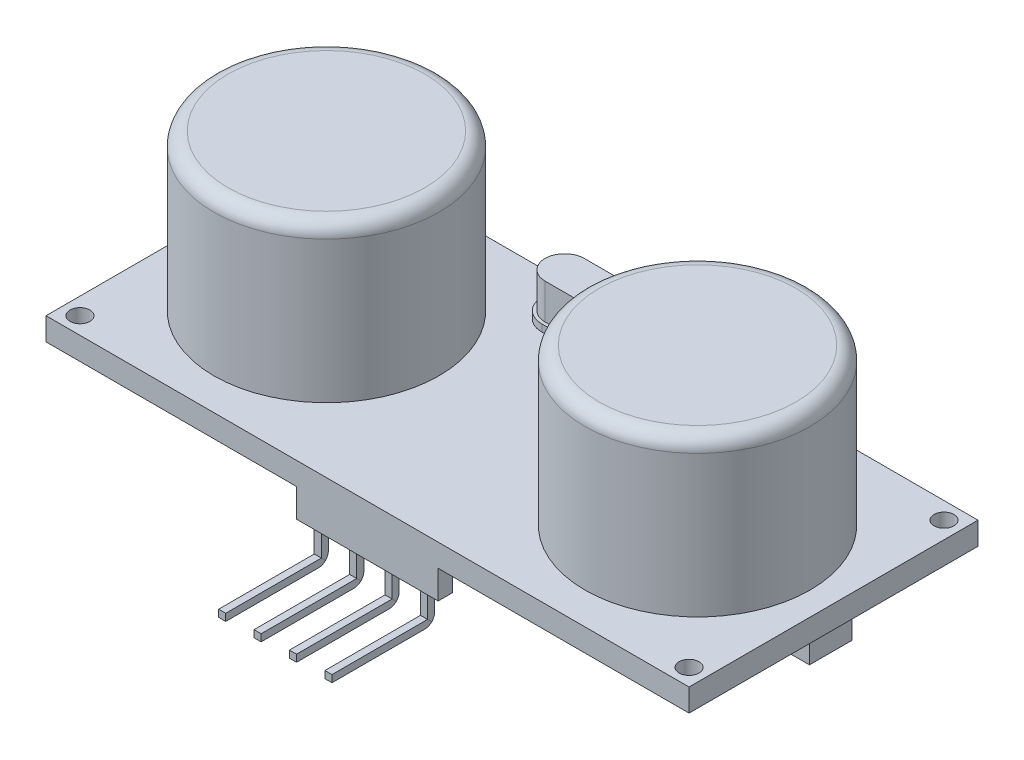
SolidWorks part; units mm, degrees
ref_plane "Alzado" through (0, 0, 0) normal (0, 0, 1) x (1, 0, 0)
ref_plane "Planta" through (0, 0, 0) normal (0, 1, 0) x (1, 0, 0)
ref_plane "Vista lateral" through (0, 0, 0) normal (1, 0, 0) x (0, 0, -1)
sketch "Croquis1" plane through (0, 0, 0) normal (0, 1, 0) x (1, 0, 0)
  line L1 (-22.7, 10.2) -> (22.7, 10.2)
  line L2 (-22.7, 10.2) -> (-22.7, -10.2)
  line L3 (-22.7, -10.2) -> (22.7, -10.2)
  line L4 (22.7, 10.2) -> (22.7, -10.2)
  line L5 (-22.7, 10.2) -> (22.7, -10.2) construction
  line L6 (-22.7, -10.2) -> (22.7, 10.2) construction
  point P0 (0, 0)
  dimension "D1" = 45.4
  dimension "D2" = 20.4
extrude "Saliente-Extruir1" add sketch "Croquis1" along normal blind 1.6
sketch "Croquis2" plane through (0, 1.6, 0) normal (0, 1, 0) x (1, 0, 0)
  line L5 (-21.5, 9) -> (21.5, -9) construction
  line L6 (-21.5, -9) -> (21.5, 9) construction
  circle A0 centre (-21.5, 9) radius 0.7
  circle A1 centre (21.5, 9) radius 0.7
  circle A2 centre (21.5, -9) radius 0.7
  circle A3 centre (-21.5, -9) radius 0.7
  point P0 (0, 0)
  dimension "D3" = 1.4
  dimension "D1" = 43
  dimension "D2" = 18
extrude "Cortar-Extruir1" cut sketch "Croquis2" against normal blind 1
sketch "Croquis3" plane through (0, 1.6, 0) normal (0, 1, 0) x (1, 0, 0)
  line L0 (0, 10.2) -> (0, -10.2) construction
  line L1 (22.7, 10.2) -> (-22.7, 10.2) construction
  line L2 (-22.7, -10.2) -> (22.7, -10.2) construction
  line L3 (-4.2022, 7.9196) -> (4.2022, 7.9196) construction
  line L4 (-4.2022, 9.5358) -> (4.2022, 9.5358)
  line L5 (-4.2022, 6.3033) -> (4.2022, 6.3033)
  line L6 (-4.2022, 7.9196) -> (4.2022, 7.9196) construction
  line L7 (-4.2022, 9.3049) -> (4.2022, 9.3049)
  line L8 (-4.2022, 6.5342) -> (4.2022, 6.5342)
  arc A0 (-4.2022, 9.5358) -> (-4.2022, 6.3033) centre (-4.2022, 7.9196) ccw
  arc A1 (4.2022, 6.3033) -> (4.2022, 9.5358) centre (4.2022, 7.9196) ccw
  arc A2 (-4.2022, 9.3049) -> (-4.2022, 6.5342) centre (-4.2022, 7.9196) ccw
  arc A3 (4.2022, 6.5342) -> (4.2022, 9.3049) centre (4.2022, 7.9196) ccw
  point P8 (0, 7.9196)
  point P15 (0, 7.9196)
extrude "Saliente-Extruir2" add sketch "Croquis3" along normal blind 0.5 contours L8 A3 L7 A2 | L5 A1 L4 A0
sketch "Croquis8" plane through (0, 1.6, 0) normal (0, 1, 0) x (1, 0, 0)
  line L0 (-4.2022, 9.3049) -> (4.2022, 9.3049) construction
  line L1 (-4.2022, 6.5342) -> (4.2022, 6.5342) construction
  line L2 (-4.2022, 9.3049) -> (4.2022, 9.3049)
  line L3 (-4.2022, 6.5342) -> (4.2022, 6.5342)
  arc A0 (4.2022, 6.5342) -> (4.2022, 9.3049) centre (4.2022, 7.9196) ccw construction
  arc A1 (-4.2022, 9.3049) -> (-4.2022, 6.5342) centre (-4.2022, 7.9196) ccw construction
  arc A2 (4.2022, 6.5342) -> (4.2022, 9.3049) centre (4.2022, 7.9196) ccw
  arc A3 (-4.2022, 9.3049) -> (-4.2022, 6.5342) centre (-4.2022, 7.9196) ccw
extrude "Saliente-Extruir3" add sketch "Croquis8" along normal blind 3
sketch "Croquis9" plane through (0, 1.6, 0) normal (0, 1, 0) x (1, 0, 0)
  line L0 (-21.05, 0) -> (21.05, 0) construction
  line L3 (-22.7, 10.2) -> (0, -10.2) construction
  line L4 (-22.7, -10.2) -> (22.7, -10.2) construction
  line L5 (0, -10.2) -> (22.7, 10.2) construction
  line L6 (-22.7, -10.2) -> (0, 10.2) construction
  line L7 (22.7, 10.2) -> (-22.7, 10.2) construction
  line L8 (0, 10.2) -> (22.7, -10.2) construction
  circle A0 centre (-13.1, 0) radius 7.95
  circle A1 centre (13.1, 0) radius 7.95
  point P2 (0, 0)
  dimension "D1" = 15.9
  dimension "D2" = 15.9
  dimension "D3" = 42.1
extrude "Saliente-Extruir4" add sketch "Croquis9" along normal blind 11
sketch "Croquis10" plane through (0, 0, 0) normal (0, -1, 0) x (1, 0, 0)
  line L0 (0, 10.2) -> (0, -10.2) construction
  line L1 (-22.7, 10.2) -> (22.7, 10.2) construction
  line L2 (22.7, -10.2) -> (-22.7, -10.2) construction
  line L3 (22.7, 0) -> (-22.7, 0) construction
  line L4 (22.7, 10.2) -> (22.7, -10.2) construction
  line L5 (-22.7, -10.2) -> (-22.7, 10.2) construction
  line L6 (-5.0127, 10.2) -> (4.9873, 10.2)
  line L7 (-5.0127, 10.2) -> (-5.0127, 9.2)
  line L8 (-5.0127, 9.2) -> (4.9873, 9.2)
  line L9 (4.9873, 9.2) -> (4.9873, 10.2)
  point P15 (-0.0127, 10.2)
  dimension "D1" = 10
  dimension "D2" = 1
extrude "Saliente-Extruir5" add sketch "Croquis10" along normal blind 2
sketch "Croquis11" plane through (0, -2, 0) normal (0, -1, 0) x (1, 0, 0)
  line L0 (-5.0127, 10.2) -> (-0.0127, 10.2) construction
  line L1 (4.9873, 10.2) -> (-5.0127, 10.2) construction
  line L2 (-2.5127, 10.2) -> (-2.5127, 9.2) construction
  line L3 (-5.0127, 9.2) -> (4.9873, 9.2) construction
  line L4 (-5.0127, 10.2) -> (-2.5127, 9.2) construction
  line L5 (-2.5127, 10.2) -> (-5.0127, 9.2) construction
sketch3d "Croquis3D1"
  line L0 (-3.7627, -2, 9.7) -> (-3.7627, -4, 9.7)
  line L1 (-5.0127, -2, 10.2) -> (-2.5127, -2, 9.2) construction
  line L2 (-3.7627, -4, 9.7) -> (-3.7627, -4, 16.7)
  dimension "D1" = 7
  dimension "D2" = 2
sketch "Croquis12" plane through (0, -2, 0) normal (0, -1, 0) x (1, 0, 0)
  line L1 (-4.0127, 9.95) -> (-3.5127, 9.95)
  line L2 (-4.0127, 9.95) -> (-4.0127, 9.45)
  line L3 (-4.0127, 9.45) -> (-3.5127, 9.45)
  line L4 (-3.5127, 9.95) -> (-3.5127, 9.45)
  line L5 (-4.0127, 9.95) -> (-3.5127, 9.45) construction
  line L6 (-4.0127, 9.45) -> (-3.5127, 9.95) construction
  point P0 (-3.7627, 9.7)
  dimension "D1" = 0.5
sweep "Barrer1" add profiles "Croquis12" path "Croquis3D1"
fillet "Redondeo4" radius 0.7 1 edges at (-3.7627, -4.25, 9.45)
pattern_linear "MatrizL1" count 4 spacing 2.5 along (1, 0, 0) of "Barrer1"
fillet "Redondeo5" radius 1 2 edges at (13.1, 12.6, 7.95) (-13.1, 12.6, 7.95)
sketch "Croquis13" plane through (0, 0, 0) normal (0, -1, 0) x (1, 0, 0)
  line L1 (-4.5, 1.5) -> (4.5, 1.5)
  line L2 (-4.5, 1.5) -> (-4.5, -1.5)
  line L3 (-4.5, -1.5) -> (4.5, -1.5)
  line L4 (4.5, 1.5) -> (4.5, -1.5)
  line L5 (-4.5, 1.5) -> (4.5, -1.5) construction
  line L6 (-4.5, -1.5) -> (4.5, 1.5) construction
  point P0 (0, 0)
  dimension "D1" = 9
  dimension "D2" = 3
extrude "Saliente-Extruir6" add sketch "Croquis13" along normal blind 1.5
pattern_linear "MatrizL2" count 2 spacing 18 along (1, 0, 0) of "Saliente-Extruir6"
sketch "Croquis14" plane through (0, 0, 0) normal (0, -1, 0) x (1, 0, 0)
  line L0 (-22.7, -10.2) -> (-22.7, 10.2) construction
  line L1 (-20.7, 4.2078) -> (-17.7, 4.2078)
  line L2 (-20.7, 4.2078) -> (-20.7, -4.7922)
  line L3 (-20.7, -4.7922) -> (-17.7, -4.7922)
  line L4 (-17.7, 4.2078) -> (-17.7, -4.7922)
  line L5 (-20.7, 4.2078) -> (-17.7, -4.7922) construction
  line L6 (-20.7, -4.7922) -> (-17.7, 4.2078) construction
  point P0 (-19.2, -0.2922)
  dimension "D1" = 3
  dimension "D2" = 2
  dimension "D3" = 9
extrude "Saliente-Extruir7" add sketch "Croquis14" along normal blind 1.5
fillet "Redondeo6" radius 0.7 3 edges at (3.7373, -4.25, 9.45) (1.2373, -4.25, 9.45) (-1.2627, -4.25, 9.45)
sketch "Sketch1" plane through (0, 1.6, 0) normal (0, 1, 0) x (1, 0, 0)
  point P0 (0, 0)
  point P3 (0, 0)
  point P5 (13.1, 7.95)
